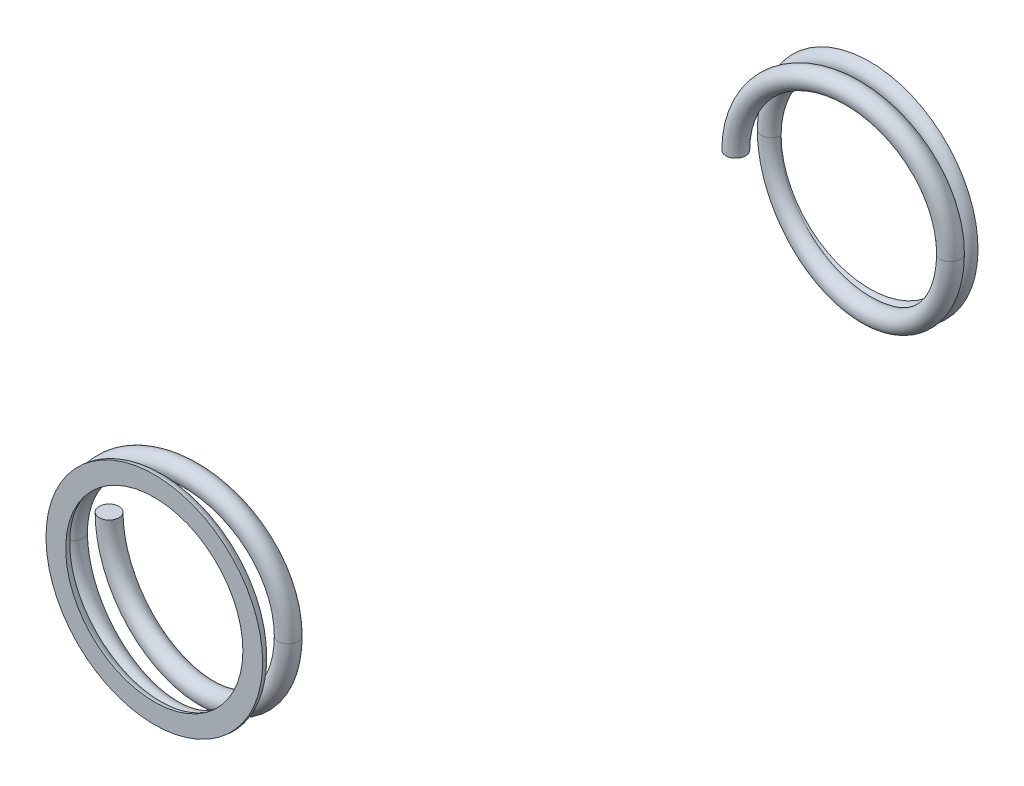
SolidWorks part; units mm, degrees
ref_plane "Front" through (0, 0, 0) normal (0, 0, 1) x (1, 0, 0)
ref_plane "Top" through (0, 0, 0) normal (0, 1, 0) x (1, 0, 0)
ref_plane "Right" through (0, 0, 0) normal (1, 0, 0) x (0, 0, -1)
sketch "Logo3_Revol_Axis" plane through (0, 0, 0) normal (0, 1, 0) x (1, 0, 0)
  line L0 (0, -10.7188) -> (0, 76.4472) construction
  line L1 (0, 0) -> (0, 53.7025) construction
sketch "Logo3_bib0" plane through (0, 0, 0) normal (0, 1, 0) x (1, 0, 0)
  line L0 (0, 0) -> (0, 73.025) construction
  line L1 (0, 73.025) -> (1.5748, 73.025) construction
  dimension "Logo3_l0" = 73.025
  dimension "Logo3_d2" = 1.5748
sketch "logo3_bib1" plane through (0, 0, 0) normal (0, 1, 0) x (1, 0, 0)
  line L0 (-8.7312, 0) -> (8.7312, 0) construction
  line L1 (8.7312, 0) -> (8.7312, 57.15) construction
  line L2 (8.7312, 57.15) -> (-8.7312, 57.15) construction
  line L3 (-8.7312, 57.15) -> (-8.7312, 0) construction
  line L4 (8.6525, 0) -> (8.6525, 57.15) construction
  line L5 (-8.6525, 57.15) -> (-8.6525, 0) construction
  line L6 (7.0777, 0) -> (7.0777, 57.15) construction
  line L7 (-7.0777, 0) -> (-7.0777, 57.15) construction
  line L8 (0, 0) -> (0, 57.15) construction
  line L9 (7.8651, 57.15) -> (7.8651, 0) construction
  line L10 (-7.8651, 57.15) -> (-7.8651, 0) construction
  line L11 (7.8651, 0) -> (-7.8651, 1.4173) construction
  line L12 (0, 0.7087) -> (0.8974, 10.6683) construction
  line L13 (-7.8651, 1.4173) -> (7.8651, 2.8346) construction
  line L14 (-7.8651, 57.15) -> (7.8651, 55.7327) construction
  line L15 (7.8651, 2.8346) -> (-7.8651, 4.252) construction
  line L16 (0, 2.126) -> (-0.8974, 12.0856) construction
  line L17 (0, 3.5433) -> (0.8974, 13.503) construction
  line L18 (0, 56.4413) -> (-0.8974, 46.4817) construction
  line L19 (-22.523, 58.5673) -> (29.4917, 58.5673) construction
  line L20 (-22.523, -1.4173) -> (25.6601, -1.4173) construction
  line L21 (7.8651, 55.7327) -> (-7.8651, 54.3154) construction
  line L22 (0, 55.024) -> (0.8974, 45.0644) construction
  line L23 (-8.7312, 57.15) -> (8.7312, 57.15) construction
  circle A0 centre (-7.8651, 57.15) radius 0.7874
  circle A1 centre (7.8651, 55.7327) radius 0.7874
  circle A2 centre (7.8651, 2.8346) radius 0.7874
  circle A3 centre (7.8651, 0) radius 0.7874
  circle A4 centre (-7.8651, 1.4173) radius 0.7874
  circle A5 centre (-7.8651, 4.252) radius 0.7874
  circle A6 centre (-7.8651, 54.3154) radius 0.7874
sketch "Sketch4" plane through (0, 0, 0) normal (0, 1, 0) x (1, 0, 0)
  line L0 (0, 0) -> (0, 57.15) construction
  line L1 (0, 0) -> (0, 57.15) construction
  circle A0 centre (7.8651, 0) radius 0.7874 construction
  circle A1 centre (-7.8651, 57.15) radius 0.7874 construction
  circle A2 centre (7.8651, 0) radius 0.7874
  circle A3 centre (-7.8651, 57.15) radius 0.7874
revolve "Revolve2" add sketch "Sketch4" angle 360 about L1
sketch "Sketch5" plane through (0, 0, 0) normal (0, 1, 0) x (1, 0, 0)
  line L0 (0, 0.7087) -> (0.8974, 10.6683) construction
  line L1 (0, 0.7087) -> (0.8974, 10.6683) construction
  circle A0 centre (7.8651, 0) radius 0.7874 construction
  circle A1 centre (7.8651, 0) radius 0.7874
revolve "Revolve3" add sketch "Sketch5" angle 180 about L1
sketch "Sketch6" plane through (0, 0, 0) normal (0, 1, 0) x (1, 0, 0)
  line L0 (0, 2.126) -> (-0.8974, 12.0856) construction
  line L1 (0, 2.126) -> (-0.8974, 12.0856) construction
  circle A0 centre (-7.8651, 1.4173) radius 0.7874 construction
  circle A1 centre (-7.8651, 1.4173) radius 0.7874
revolve "Revolve4" add sketch "Sketch6" angle 180 about L1
sketch "Sketch7" plane through (0, 0, 0) normal (0, 1, 0) x (1, 0, 0)
  line L0 (0, 3.5433) -> (0.8974, 13.503) construction
  line L1 (0, 3.5433) -> (0.8974, 13.503) construction
  circle A0 centre (7.8651, 2.8346) radius 0.7874 construction
  circle A1 centre (7.8651, 2.8346) radius 0.7874
revolve "Revolve5" add sketch "Sketch7" angle 180 about L1
sketch "Sketch8" plane through (0, 0, 0) normal (0, 1, 0) x (1, 0, 0)
  line L0 (0, 56.4413) -> (-0.8974, 46.4817) construction
  line L1 (0, 56.4413) -> (-0.8974, 46.4817) construction
  circle A0 centre (-7.8651, 57.15) radius 0.7874 construction
  circle A1 centre (-7.8651, 57.15) radius 0.7874
revolve "Revolve6" add sketch "Sketch8" angle 180 about L1
sketch "Sketch10" plane through (0, 0, 0) normal (0, 1, 0) x (1, 0, 0)
  line L0 (0, 55.024) -> (0.8974, 45.0644) construction
  line L1 (0, 55.024) -> (0.8974, 45.0644) construction
  circle A0 centre (7.8651, 55.7327) radius 0.7874 construction
  circle A1 centre (7.8651, 55.7327) radius 0.7874
revolve "Revolve7" add sketch "Sketch10" angle 180 about L1
sketch "Sketch9" plane through (0, 0, 0) normal (0, 1, 0) x (1, 0, 0)
  line L1 (-8.6525, 0) -> (8.6525, 0)
  line L2 (-8.6525, 0) -> (-8.6525, -1.4173)
  line L3 (-8.6525, -1.4173) -> (8.6525, -1.4173)
  line L4 (8.6525, 0) -> (8.6525, -1.4173)
  line L6 (8.6525, 57.15) -> (-8.6525, 57.15)
  line L7 (8.6525, 57.15) -> (8.6525, 58.5673)
  line L8 (8.6525, 58.5673) -> (-8.6525, 58.5673)
  line L9 (-8.6525, 57.15) -> (-8.6525, 58.5673)
  line L10 (-22.523, -1.4173) -> (25.6601, -1.4173) construction
  line L11 (-22.523, 58.5673) -> (29.4917, 58.5673) construction
  line L12 (-8.6525, 57.15) -> (-8.6525, 0) construction
  line L13 (8.6525, 0) -> (8.6525, 57.15) construction
extrude "Cut-Extrude1" cut sketch "Sketch9" against normal through all and the other way through all
sketch "Sketch11" plane through (0, 0, 0) normal (0, 1, 0) x (1, 0, 0)
  line L0 (7.8651, 57.15) -> (7.8651, 0) construction
  line L1 (-7.8651, 57.15) -> (-7.8651, 0) construction
  line L2 (7.8651, 57.15) -> (7.8651, 0) construction
  line L3 (-7.8651, 57.15) -> (-7.8651, 0) construction
equation "\"Ray1@logo3_bib1\" = \"Logo3_d1/2-1.05*d2@logo3_bib1\""
equation "\"Ray2@logo3_bib1\" = \"Logo3_(d1-(.1*d2))/2@logo3_bib1\""
equation "\"Ray3@logo3_bib1\" = (\"Ray1@logo3_bib1\"+\"Ray2@logo3_bib1\")/2"
equation "\"Ray3bis@logo3_bib1\" = \"Ray3@logo3_bib1\""
equation "\"Dist1@logo3_bib1\" = (\"Logo3_(d1-(.1*d2))/2@logo3_bib1\"-\"Logo3_d1/2-1.05*d2@logo3_bib1\")*.9"
equation "\"Dist2@logo3_bib1\" = \"Dist1@logo3_bib1\"*2"
equation "\"Dist3@logo3_bib1\" = \"Dist1@logo3_bib1\"*3"
equation "\"Dist1bis@logo3_bib1\" = \"Dist1@logo3_bib1\""
equation "\"Dist4@logo3_bib1\" = \"Dist1@logo3_bib1\""
equation "\"Dist5@logo3_bib1\" = \"Dist4@logo3_bib1\""
equation "\"Dist2bis@logo3_bib1\" = \"Dist2@logo3_bib1\""
